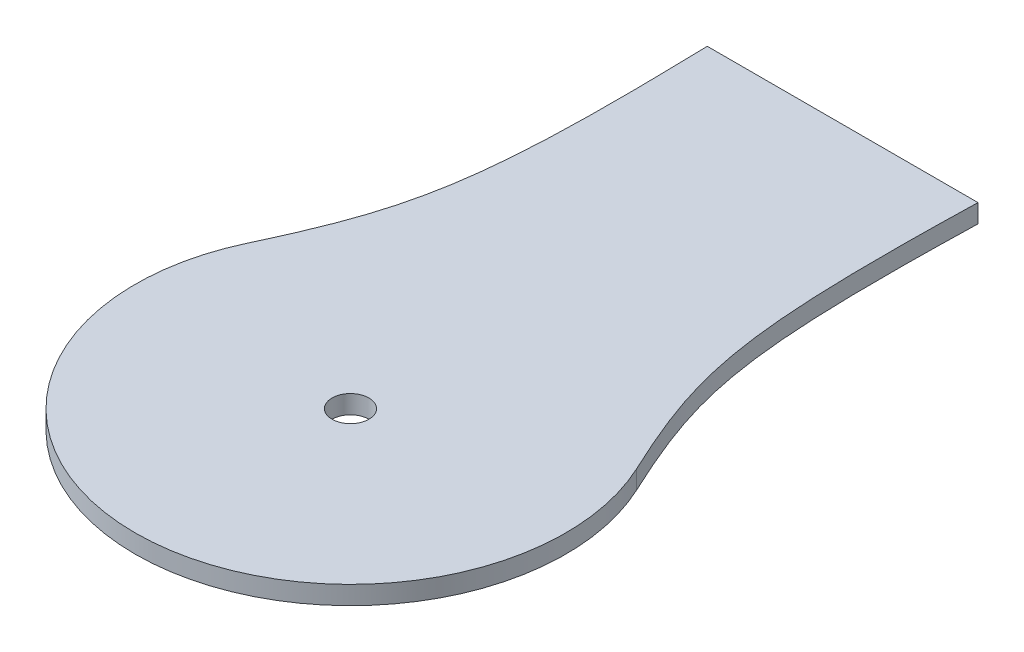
SolidWorks part; units mm, degrees
ref_plane "Ebene vorne" through (0, 0, 0) normal (0, 0, 1) x (1, 0, 0)
ref_plane "Ebene oben" through (0, 0, 0) normal (0, 1, 0) x (1, 0, 0)
ref_plane "Ebene rechts" through (0, 0, 0) normal (1, 0, 0) x (0, 0, -1)
sketch "Skizze1" plane through (0, 0, 0) normal (0, 1, 0) x (1, 0, 0)
  line L0 (0, 90.0934) -> (0, -75.4573) construction
  line L1 (-79.035, 0) -> (73.5058, 0) construction
  line L3 (-11, 0) -> (11, 0)
  circle A0 centre (0, -40) radius 17.5 construction
  arc A1 (-15.8537, -32.5899) -> (15.8537, -32.5899) centre (0, -40) ccw
  circle A2 centre (0, -40) radius 1.5
  spline S0 degree 3 poles (-15.8537, -32.5899) (-11.5871, -23.4616) (-10.5073, -18.9209) (-11, 0) knots 0 0 0 0 1 1 1 1
  spline S1 degree 3 poles (15.8537, -32.5899) (11.5871, -23.4616) (10.5073, -18.9209) (11, 0) knots 0 0 0 0 1 1 1 1
  dimension "D3" = 40
  dimension "D2" = 35
  dimension "D4" = 3
  dimension "D1" = 22
extrude "Aufsatz-Linear austragen1" add sketch "Skizze1" along normal blind 1.5
